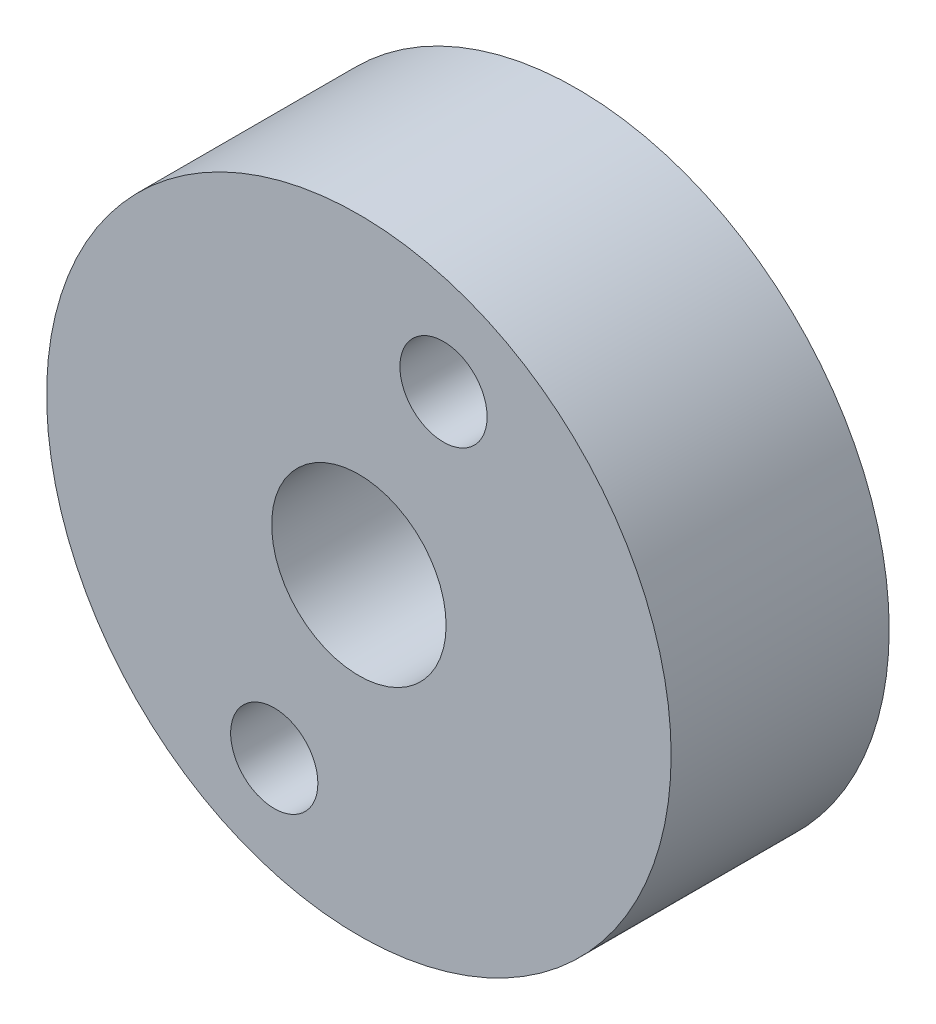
SolidWorks part; units mm, degrees
ref_plane "Front Plane" through (0, 0, 0) normal (0, 0, 1) x (1, 0, 0)
ref_plane "Top Plane" through (0, 0, 0) normal (0, 1, 0) x (1, 0, 0)
ref_plane "Right Plane" through (0, 0, 0) normal (1, 0, 0) x (0, 0, -1)
sketch "Sketch1" plane through (0, 0, 0) normal (0, 0, 1) x (1, 0, 0)
  circle A0 centre (0, 0) radius 7.16
extrude "Boss-Extrude1" add sketch "Sketch1" along normal blind 5
sketch "Sketch2" plane through (0, 0, 5) normal (0, 0, 1) x (1, 0, 0)
  line L0 (0, 0) -> (21.3269, 0) construction
  line L1 (0, 0) -> (7.213, 17.1294) construction
  line L2 (0, 0) -> (-5.5281, -13.1281) construction
  circle A0 centre (0, 0) radius 2
  circle A1 centre (1.9404, 4.6081) radius 1
  circle A2 centre (-1.9404, -4.6081) radius 1
  dimension "D1" = 67.165
  dimension "D3" = 5
  dimension "D4" = 5
  dimension "D2" = 180
extrude "Cut-Extrude1" cut sketch "Sketch2" against normal blind 5
sketch "Sketch3" plane through (0, 0, 5) normal (0, 0, 1) x (1, 0, 0)
  line L0 (0, 0) -> (7.16, 0)
  circle A0 centre (0, 0) radius 7.16 construction
